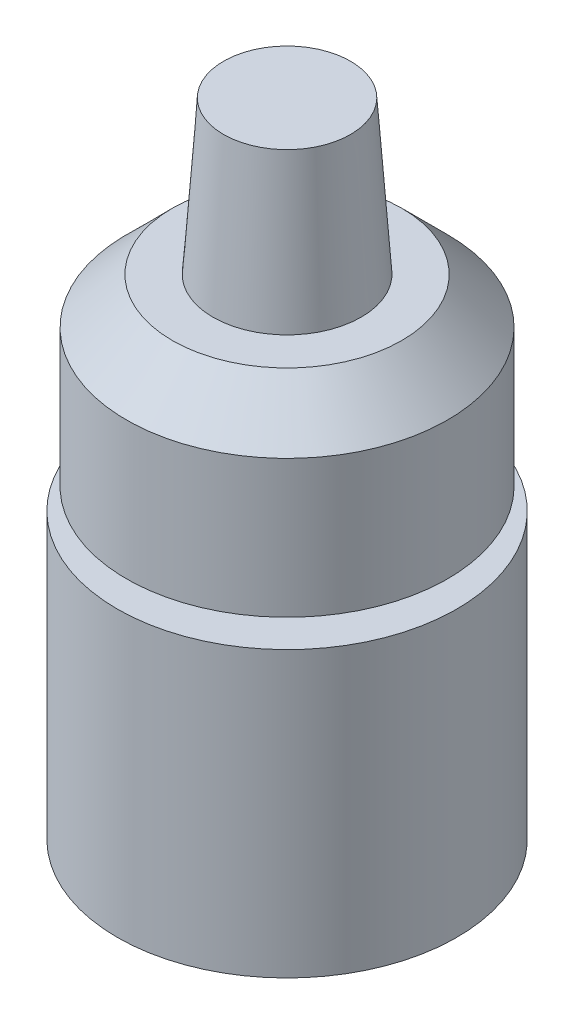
SolidWorks part; units mm, degrees
ref_plane "前视基准面" through (0, 0, 0) normal (0, 0, 1) x (1, 0, 0)
ref_plane "上视基准面" through (0, 0, 0) normal (0, 1, 0) x (1, 0, 0)
ref_plane "右视基准面" through (0, 0, 0) normal (1, 0, 0) x (0, 0, -1)
sketch "草图1" plane through (0, 0, 0) normal (0, 1, 0) x (1, 0, 0)
  circle A0 centre (0, 0) radius 11.11
  dimension "D1" = 22.22
extrude "凸台-拉伸1" add sketch "草图1" along normal blind 18.6
sketch "草图2" plane through (0, 18.6, 0) normal (0, 1, 0) x (1, 0, 0)
  circle A0 centre (0, 0) radius 5.15
  dimension "D1" = 10.3
extrude "凸台-拉伸2" add sketch "草图2" along normal blind 7.93
sketch "草图3" plane through (0, 26.53, 0) normal (0, 1, 0) x (1, 0, 0)
  circle A0 centre (0, 0) radius 3.3546
extrude "凸台-拉伸3" add sketch "草图3" along normal blind 12.69
ref_plane "基准面1" through (0, 20, 0) normal (0, -1, 0) x (-1, 0, 0)
sketch "草图4" plane through (0, 20, 0) normal (0, -1, 0) x (-1, 0, 0)
  circle A0 centre (0, 0) radius 10.5
  dimension "D1" = 21
extrude "凸台-拉伸4" add sketch "草图4" against normal blind 12
chamfer "倒角1" distance 3 angle 45 1 edges at (0, 32, -10.5)
sketch "草图5" plane through (0, 32, 0) normal (0, 1, 0) x (1, 0, 0)
  circle A0 centre (0, 0) radius 4.8516
extrude "凸台-拉伸5" add sketch "草图5" along normal blind 10 draft 4
